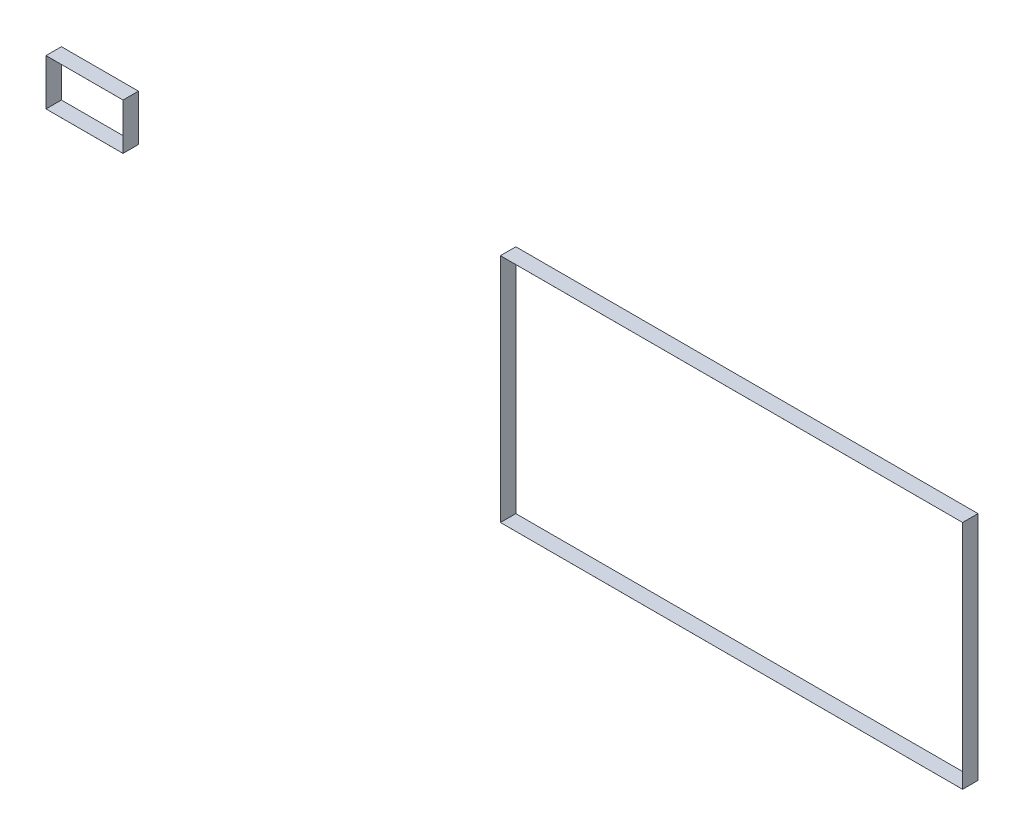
SolidWorks part; units mm, degrees
ref_plane "Plan XY" through (0, 0, 0) normal (0, 0, 1) x (1, 0, 0)
ref_plane "Plan XZ" through (0, 0, 0) normal (0, 1, 0) x (1, 0, 0)
ref_plane "Plan YZ" through (0, 0, 0) normal (1, 0, 0) x (0, 0, -1)
other "Centre de masse"
sketch "2 postes" plane through (0, 0, 0) normal (0, 0, 1) x (1, 0, 0)
  line L0 (2.5, 10) -> (7.5, 10) construction
  line L1 (0, 0) -> (30, 0)
  line L2 (0, 0) -> (0, 15)
  line L3 (0, 15) -> (30, 15)
  line L4 (30, 0) -> (30, 15)
  line L5 (2.5, 11.5) -> (7.5, 11.5) construction
  line L6 (2.5, 11.5) -> (2.5, 8.5) construction
  line L7 (2.5, 8.5) -> (7.5, 8.5) construction
  line L8 (7.5, 11.5) -> (7.5, 8.5) construction
  line L9 (5, 11.5) -> (5, 8.5) construction
  line L10 (-27, 11.5) -> (-27, 8.5) construction
  line L11 (-29.5, 11.5) -> (-24.5, 11.5)
  line L12 (-29.5, 11.5) -> (-29.5, 8.5)
  line L13 (-29.5, 8.5) -> (-24.5, 8.5)
  line L14 (-24.5, 11.5) -> (-24.5, 8.5)
  line L15 (-32, 15) -> (-2, 15) construction
  line L16 (-32, 15) -> (-32, 0) construction
  line L17 (-32, 0) -> (-2, 0) construction
  line L18 (-2, 15) -> (-2, 0) construction
  line L19 (-29.5, 10) -> (-24.5, 10) construction
  dimension "D1" = 30
  dimension "D2" = 15
  dimension "D3" = 5
  dimension "D4" = 3
  dimension "D5" = 10
  dimension "D6" = 5
  dimension "D7" = 5
  dimension "D8" = 2
  dimension "D9" = 5
  dimension "D10" = 30
  dimension "D11" = 32
extrude "Extru.-Mince1" add sketch "2 postes" along normal blind 1 thin
other "Point de référence du centre de masse1"
equation "\"D10@2 postes\"= \"D1@2 postes\""
equation "\"D7@2 postes\"= \"D3@2 postes\""
equation "\"D9@2 postes\"= \"D6@2 postes\""
